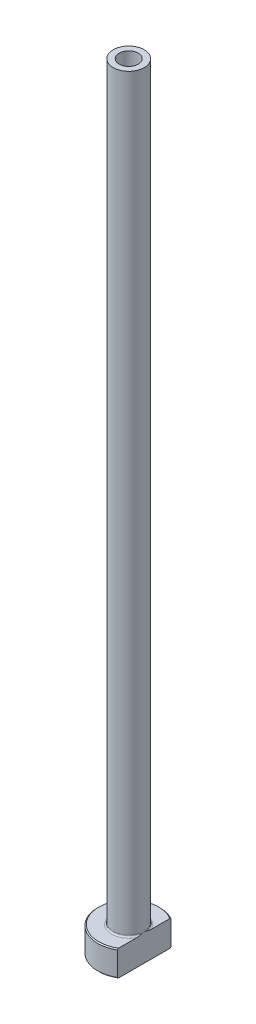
SolidWorks part; units mm, degrees
ref_plane "Front Plane" through (0, 0, 0) normal (0, 0, 1) x (1, 0, 0)
ref_plane "Top Plane" through (0, 0, 0) normal (0, 1, 0) x (1, 0, 0)
ref_plane "Right Plane" through (0, 0, 0) normal (1, 0, 0) x (0, 0, -1)
sketch "Sketch1" plane through (0, 0, 0) normal (0, 0, 1) x (1, 0, 0)
  line L0 (-1.85, 150) -> (-3, 150)
  line L1 (-3, 150) -> (-3, 5)
  line L2 (-3, 5) -> (-6, 5)
  line L3 (-6, 5) -> (-6, 0)
  line L4 (4.95, 0) -> (-4.95, 0) construction
  line L5 (-6, 0) -> (-2.1, 0)
  line L6 (-1.85, 105) -> (-1.85, 150)
  line L7 (0, 92.1877) -> (0, -15.5353) construction
  line L8 (0, -6.6) -> (0, 6.6) construction
  line L9 (-1.85, 105) -> (-2.1, 93)
  line L10 (-2.1, 93) -> (-2.1, 0)
  dimension "D1" = 0.25
  dimension "ID" = 3.7
  dimension "OD" = 6
  dimension "L" = 150
  dimension "H" = 12
  dimension "T" = 5
  dimension "N" = 45
  dimension "D2" = 12
  dimension "L-N" = 105
revolve "Revolve1" add sketch "Sketch1" angle 360 about L7
fillet "Fillet1" radius 0.3 1 edges at (0, 5, 3)
chamfer "Chamfer1" distance 0.2 angle 45 2 edges at (0, 5, 6) (0, 0, 6)
sketch "Sketch2" plane through (0, 0, 0) normal (0, -1, 0) x (1, 0, 0)
  line L0 (3, 5.1962) -> (3, -5.1962)
  circle A0 centre (0, 0) radius 6 construction
  arc A1 (3, 5.1962) -> (3, -5.1962) centre (0, 0) cw
  circle A2 centre (0, 0) radius 3 construction
extrude "Cut-Extrude1" cut sketch "Sketch2" against normal through all
chamfer "Chamfer2" distance 0.5 angle 45 1 edges at (0, 0, 2.1)
